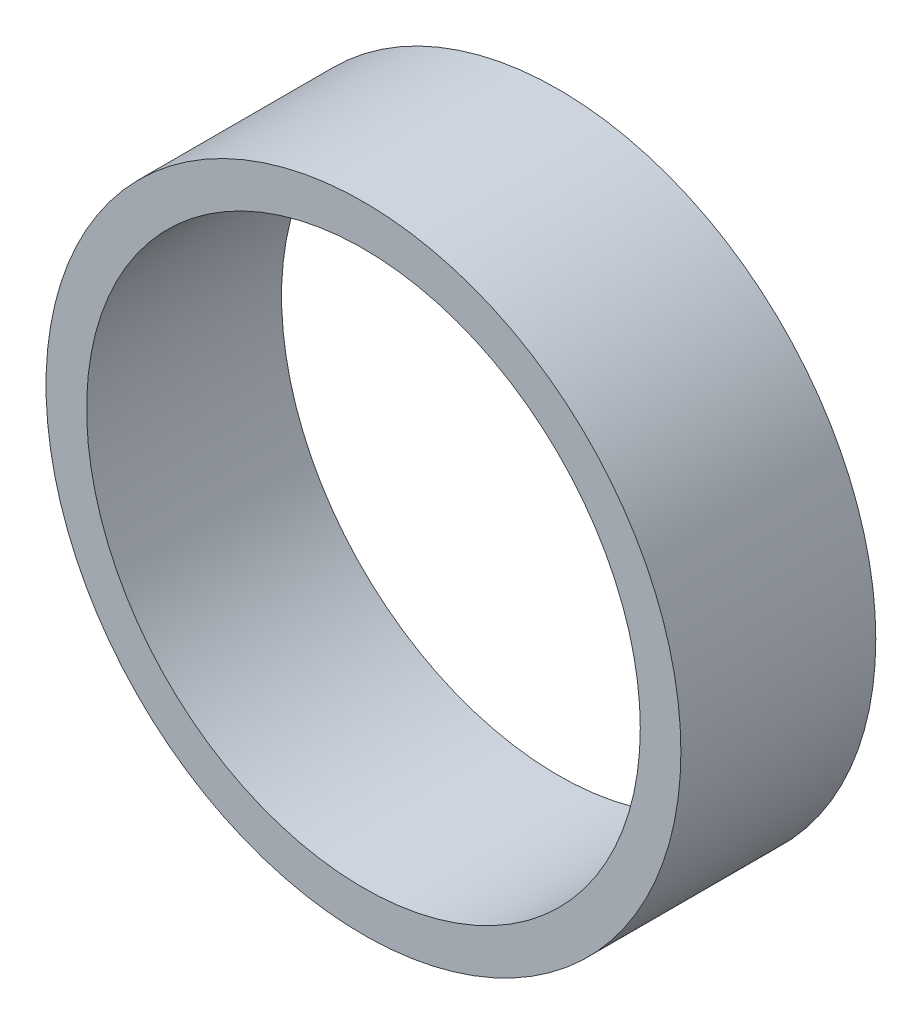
SolidWorks part; units mm, degrees
ref_plane "Plan de face" through (0, 0, 0) normal (0, 0, 1) x (1, 0, 0)
ref_plane "Plan de dessus" through (0, 0, 0) normal (0, 1, 0) x (1, 0, 0)
ref_plane "Plan de droite" through (0, 0, 0) normal (1, 0, 0) x (0, 0, -1)
sketch "Esquisse1" plane through (0, 0, 0) normal (0, 0, 1) x (1, 0, 0)
  circle A0 centre (0, 0) radius 18.75
  circle A1 centre (0, 0) radius 21.5
  dimension "D1" = 43
  dimension "D2" = 37.5
extrude "Extrusion1" add sketch "Esquisse1" along normal blind 13.2
